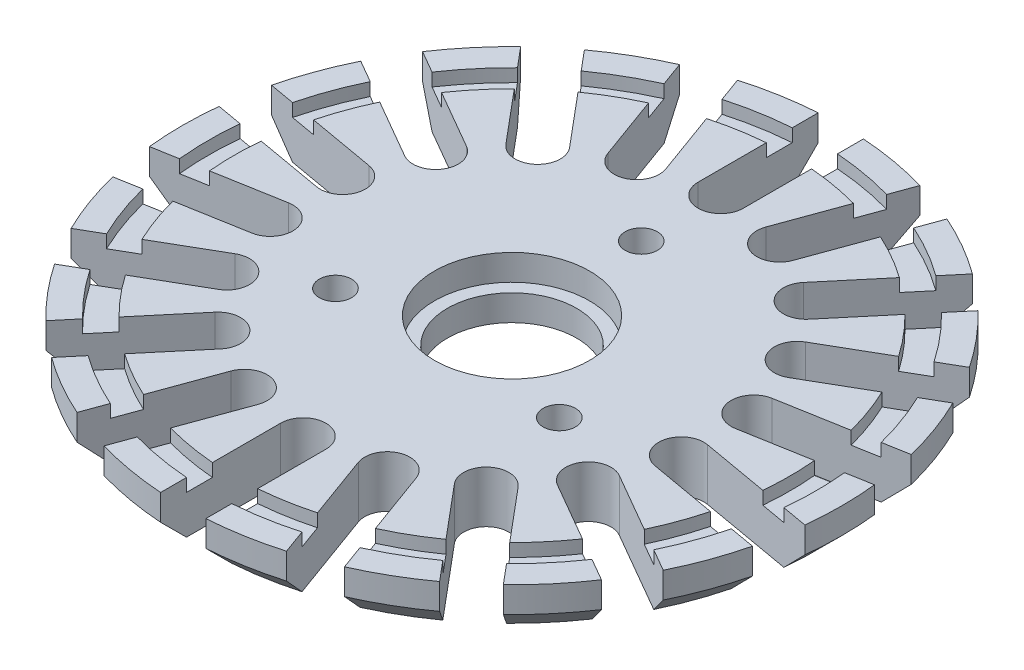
SolidWorks part; units mm, degrees
ref_plane "Plano frontal" through (0, 0, 0) normal (0, 0, 1) x (1, 0, 0)
ref_plane "Plano superior" through (0, 0, 0) normal (0, 1, 0) x (1, 0, 0)
ref_plane "Plano direito" through (0, 0, 0) normal (1, 0, 0) x (0, 0, -1)
sketch "Esboço1" plane through (0, 0, 0) normal (0, 1, 0) x (1, 0, 0)
  line L0 (1.75, 16.15) -> (1.75, 25.4399)
  line L1 (-1.75, 16.15) -> (-1.75, 25.4399)
  line L2 (3.8792, 15.7746) -> (7.0565, 24.5042)
  line L3 (7.1681, 14.5775) -> (10.3454, 23.3071)
  line L4 (9.0404, 13.4965) -> (15.0119, 20.613)
  line L5 (11.7216, 11.2467) -> (17.693, 18.3632)
  line L6 (13.1113, 9.5905) -> (21.1566, 14.2355)
  line L7 (14.8613, 6.5595) -> (22.9066, 11.2044)
  line L8 (15.6008, 4.5278) -> (24.7495, 6.141)
  line L9 (16.2085, 1.081) -> (25.3573, 2.6942)
  line L10 (16.2085, -1.081) -> (25.3573, -2.6942)
  line L11 (15.6008, -4.5278) -> (24.7495, -6.141)
  line L12 (14.8613, -6.5595) -> (22.9066, -11.2044)
  line L13 (13.1113, -9.5905) -> (21.1566, -14.2355)
  line L14 (11.7216, -11.2467) -> (17.693, -18.3632)
  line L15 (9.0404, -13.4965) -> (15.0119, -20.613)
  line L16 (7.1681, -14.5775) -> (10.3454, -23.3071)
  line L17 (3.8792, -15.7746) -> (7.0565, -24.5042)
  line L18 (1.75, -16.15) -> (1.75, -25.4399)
  line L19 (-1.75, -16.15) -> (-1.75, -25.4399)
  line L20 (-3.8792, -15.7746) -> (-7.0565, -24.5042)
  line L21 (-7.1681, -14.5775) -> (-10.3454, -23.3071)
  line L22 (-9.0404, -13.4965) -> (-15.0119, -20.613)
  line L23 (-11.7216, -11.2467) -> (-17.693, -18.3632)
  line L24 (-13.1113, -9.5905) -> (-21.1566, -14.2355)
  line L25 (-14.8613, -6.5595) -> (-22.9066, -11.2044)
  line L26 (-15.6008, -4.5278) -> (-24.7495, -6.141)
  line L27 (-16.2085, -1.081) -> (-25.3573, -2.6942)
  line L28 (-16.2085, 1.081) -> (-25.3573, 2.6942)
  line L29 (-15.6008, 4.5278) -> (-24.7495, 6.141)
  line L30 (-14.8613, 6.5595) -> (-22.9066, 11.2044)
  line L31 (-13.1113, 9.5905) -> (-21.1566, 14.2355)
  line L32 (-11.7216, 11.2467) -> (-17.693, 18.3632)
  line L33 (-9.0404, 13.4965) -> (-15.0119, 20.613)
  line L34 (-7.1681, 14.5775) -> (-10.3454, 23.3071)
  line L35 (-3.8792, 15.7746) -> (-7.0565, 24.5042)
  arc A0 (-1.75, 25.4399) -> (-7.0565, 24.5042) centre (0, 0) ccw
  circle A1 centre (0, 0) radius 5
  circle A2 centre (0, 0) radius 16.15 construction
  arc A3 (-1.75, 16.15) -> (1.75, 16.15) centre (0, 16.15) ccw
  arc A4 (3.8792, 15.7746) -> (7.1681, 14.5775) centre (5.5236, 15.176) ccw
  arc A5 (9.0404, 13.4965) -> (11.7216, 11.2467) centre (10.381, 12.3716) ccw
  arc A6 (13.1113, 9.5905) -> (14.8613, 6.5595) centre (13.9863, 8.075) ccw
  arc A7 (15.6008, 4.5278) -> (16.2085, 1.081) centre (15.9046, 2.8044) ccw
  arc A8 (16.2085, -1.081) -> (15.6008, -4.5278) centre (15.9046, -2.8044) ccw
  arc A9 (14.8613, -6.5595) -> (13.1113, -9.5905) centre (13.9863, -8.075) ccw
  arc A10 (11.7216, -11.2467) -> (9.0404, -13.4965) centre (10.381, -12.3716) ccw
  arc A11 (7.1681, -14.5775) -> (3.8792, -15.7746) centre (5.5236, -15.176) ccw
  arc A12 (1.75, -16.15) -> (-1.75, -16.15) centre (0, -16.15) ccw
  arc A13 (-3.8792, -15.7746) -> (-7.1681, -14.5775) centre (-5.5236, -15.176) ccw
  arc A14 (-9.0404, -13.4965) -> (-11.7216, -11.2467) centre (-10.381, -12.3716) ccw
  arc A15 (-13.1113, -9.5905) -> (-14.8613, -6.5595) centre (-13.9863, -8.075) ccw
  arc A16 (-15.6008, -4.5278) -> (-16.2085, -1.081) centre (-15.9046, -2.8044) ccw
  arc A17 (-16.2085, 1.081) -> (-15.6008, 4.5278) centre (-15.9046, 2.8044) ccw
  arc A18 (-14.8613, 6.5595) -> (-13.1113, 9.5905) centre (-13.9863, 8.075) ccw
  arc A19 (-11.7216, 11.2467) -> (-9.0404, 13.4965) centre (-10.381, 12.3716) ccw
  arc A20 (-7.1681, 14.5775) -> (-3.8792, 15.7746) centre (-5.5236, 15.176) ccw
  arc A21 (-10.3454, 23.3071) -> (-15.0119, 20.613) centre (0, 0) ccw
  arc A22 (7.0565, 24.5042) -> (1.75, 25.4399) centre (0, 0) ccw
  arc A23 (-17.693, 18.3632) -> (-21.1566, 14.2355) centre (0, 0) ccw
  arc A24 (-22.9066, 11.2044) -> (-24.7495, 6.141) centre (0, 0) ccw
  arc A25 (-25.3573, 2.6942) -> (-25.3573, -2.6942) centre (0, 0) ccw
  arc A26 (-24.7495, -6.141) -> (-22.9066, -11.2044) centre (0, 0) ccw
  arc A27 (-21.1566, -14.2355) -> (-17.693, -18.3632) centre (0, 0) ccw
  arc A28 (-15.0119, -20.613) -> (-10.3454, -23.3071) centre (0, 0) ccw
  arc A29 (-7.0565, -24.5042) -> (-1.75, -25.4399) centre (0, 0) ccw
  arc A30 (1.75, -25.4399) -> (7.0565, -24.5042) centre (0, 0) ccw
  arc A31 (10.3454, -23.3071) -> (15.0119, -20.613) centre (0, 0) ccw
  arc A32 (17.693, -18.3632) -> (21.1566, -14.2355) centre (0, 0) ccw
  arc A33 (22.9066, -11.2044) -> (24.7495, -6.141) centre (0, 0) ccw
  arc A34 (25.3573, -2.6942) -> (25.3573, 2.6942) centre (0, 0) ccw
  arc A35 (24.7495, 6.141) -> (22.9066, 11.2044) centre (0, 0) ccw
  arc A36 (21.1566, 14.2355) -> (17.693, 18.3632) centre (0, 0) ccw
  arc A37 (15.0119, 20.613) -> (10.3454, 23.3071) centre (0, 0) ccw
  dimension "D1" = 51
  dimension "D2" = 10
  dimension "D3" = 32.3
  dimension "D4" = 3.5
  dimension "D5" = 9.2899
extrude "Ressalto-extrusão1" add sketch "Esboço1" along normal blind 4
sketch "Esboço2" plane through (0, 4, 0) normal (0, 1, 0) x (1, 0, 0)
  circle A0 centre (0, 0) radius 6
  dimension "D1" = 12
extrude "Corte-extrusão1" cut sketch "Esboço2" against normal blind 2
sketch "Esboço3" plane through (0, 4, 0) normal (0, 1, 0) x (1, 0, 0)
  circle A0 centre (0, 0) radius 23.5
  circle A1 centre (0, 0) radius 21.5
  dimension "D1" = 47
  dimension "D2" = 43
extrude "Corte-extrusão2" cut sketch "Esboço3" against normal blind 1
chamfer "Chanfro1" distance 2 angle 45 18 edges at (25.5, 0, 0) (23.9622, 0, 8.7215) (19.5341, 0, 16.3911) (12.75, 0, 22.0836) (4.428, 0, 25.1126) (-4.428, 0, 25.1126) (-12.75, 0, 22.0836) (-19.5341, 0, 16.3911) (-23.9622, 0, 8.7215) (-25.5, 0, 0) (-23.9622, 0, -8.7215) (-19.5341, 0, -16.3911) (-12.75, 0, -22.0836) (-4.428, 0, -25.1126) (4.428, 0, -25.1126) (12.75, 0, -22.0836) (19.5341, 0, -16.3911) (23.9622, 0, -8.7215)
sketch "Esboço4" plane through (0, 0, 0) normal (0, -1, 0) x (1, 0, 0)
  line L0 (0, -10) -> (0, 10) construction
  circle A0 centre (0, 0) radius 10 construction
  circle A1 centre (0, -10) radius 1.25
  circle A2 centre (-8.6603, 5) radius 1.25
  circle A3 centre (8.6603, 5) radius 1.25
  dimension "D1" = 20
  dimension "D2" = 2.5
  dimension "D4" = 10
  dimension "D5" = 10
  dimension "D6" = 20
  dimension "D3" = 3
extrude "Corte-extrusão3" cut sketch "Esboço4" against normal through all
sketch "Esboço5" [suppressed] plane through (0, 0, 0) normal (0, -1, 0) x (1, 0, 0)
  line L0 (0, 0) -> (8.6603, 5) construction
  line L1 (0, 0) -> (-8.6603, 5) construction
  line L2 (0, 0) -> (0, -10) construction
  line L4 (11.4303, 5) -> (10.0453, 7.3989)
  line L5 (10.0453, 7.3989) -> (7.2753, 7.3989)
  line L6 (7.2753, 7.3989) -> (5.8903, 5)
  line L7 (5.8903, 5) -> (7.2753, 2.6011)
  line L8 (7.2753, 2.6011) -> (10.0453, 2.6011)
  line L9 (10.0453, 2.6011) -> (11.4303, 5)
  line L10 (-5.8903, 5) -> (-7.2753, 7.3989)
  line L11 (-7.2753, 7.3989) -> (-10.0453, 7.3989)
  line L12 (-10.0453, 7.3989) -> (-11.4303, 5)
  line L13 (-11.4303, 5) -> (-10.0453, 2.6011)
  line L14 (-10.0453, 2.6011) -> (-7.2753, 2.6011)
  line L15 (-7.2753, 2.6011) -> (-5.8903, 5)
  line L16 (2.77, -10) -> (1.385, -7.6011)
  line L17 (1.385, -7.6011) -> (-1.385, -7.6011)
  line L18 (-1.385, -7.6011) -> (-2.77, -10)
  line L19 (-2.77, -10) -> (-1.385, -12.3989)
  line L20 (-1.385, -12.3989) -> (1.385, -12.3989)
  line L21 (1.385, -12.3989) -> (2.77, -10)
  circle A0 centre (8.6603, 5) radius 2.3989 construction
  circle A1 centre (-8.6603, 5) radius 2.3989 construction
  circle A2 centre (0, -10) radius 2.3989 construction
  dimension "D1" = 2.77
extrude "Corte-extrusão4" [suppressed] cut sketch "Esboço5" against normal blind 0.42
